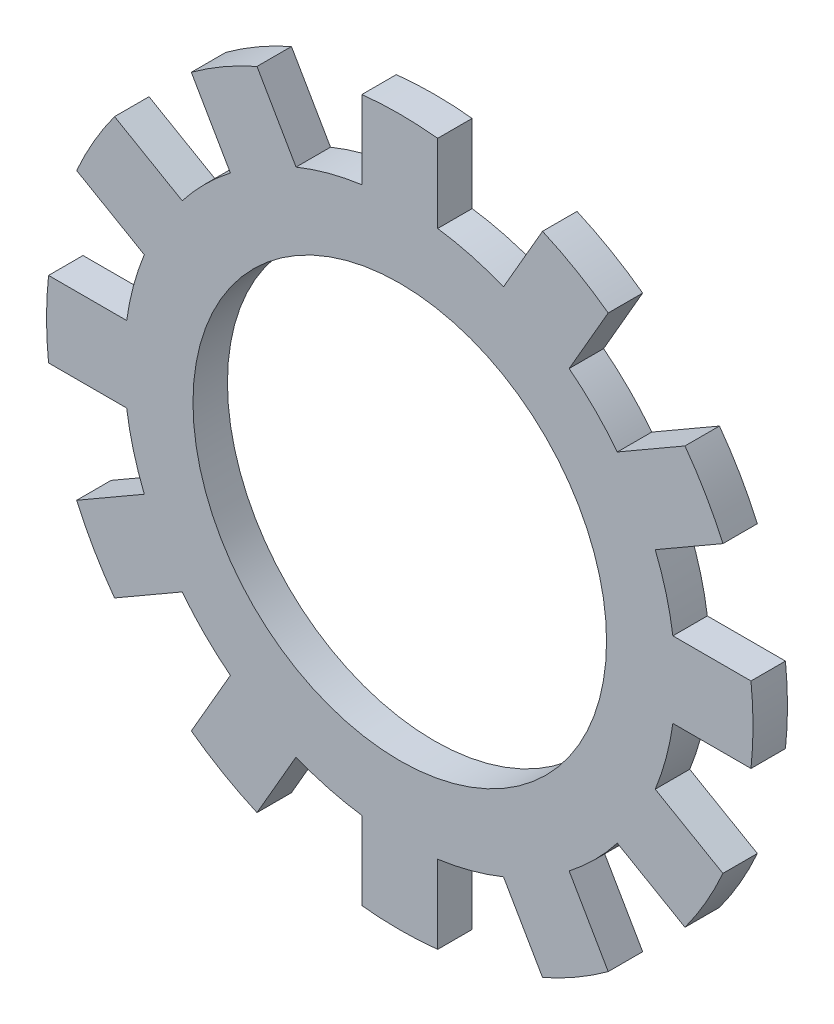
SolidWorks part; units mm, degrees
ref_plane "Front Plane" through (0, 0, 0) normal (0, 0, 1) x (1, 0, 0)
ref_plane "Top Plane" through (0, 0, 0) normal (0, 1, 0) x (1, 0, 0)
ref_plane "Right Plane" through (0, 0, 0) normal (1, 0, 0) x (0, 0, -1)
sketch "Sketch1" plane through (0, 0, 0) normal (0, 0, 1) x (1, 0, 0)
  circle A0 centre (0, 0) radius 6
  circle A1 centre (0, 0) radius 8
  dimension "D1" = 12
  dimension "D2" = 16
extrude "Boss-Extrude1" add sketch "Sketch1" along normal mid plane 1
sketch "Sketch2" plane through (0, 0, 0) normal (0, 0, 1) x (1, 0, 0)
  line L0 (0, 2.6811) -> (0, -2.8425) construction
sketch "Sketch3" plane through (0, 0, 0) normal (0, 0, 1) x (1, 0, 0)
  line L0 (-1.1, 10.1908) -> (-1.1, 7.924)
  line L2 (0, 2.6811) -> (0, -2.8425) construction
  line L3 (0, 8) -> (0, 10.25)
  arc A0 (0, 10.25) -> (-1.1, 10.1908) centre (0, 0) ccw
  arc A1 (0, 8) -> (-1.1, 7.924) centre (0, 0) ccw
  circle A2 centre (0, 0) radius 8 construction
  dimension "D2" = 10.25
  dimension "D1" = 1.1
extrude "Boss-Extrude2" add sketch "Sketch3" along normal mid plane 1
mirror "Mirror1" about plane through (0, 0, 0) normal (1, 0, 0) of "Boss-Extrude2"
pattern_circular "CirPattern2" count 12 over 360 about axis through (0, 0, 0) along (0, 0, 1) of "Boss-Extrude2", "Mirror1"
